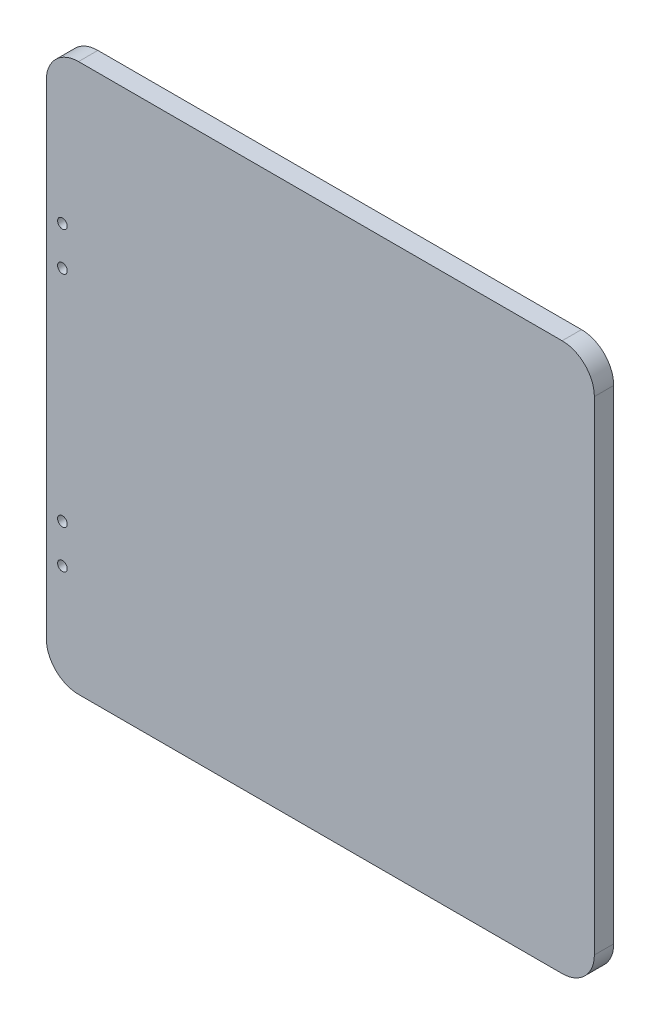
SolidWorks part; units mm, degrees
ref_plane "Front Plane" through (0, 0, 0) normal (0, 0, 1) x (1, 0, 0)
ref_plane "Top Plane" through (0, 0, 0) normal (0, 1, 0) x (1, 0, 0)
ref_plane "Right Plane" through (0, 0, 0) normal (1, 0, 0) x (0, 0, -1)
sketch "Sketch1" plane through (0, 0, 0) normal (0, 0, 1) x (1, 0, 0)
  line L1 (85, -85) -> (-85, -85)
  line L2 (85, -85) -> (85, 85)
  line L3 (85, 85) -> (-85, 85)
  line L4 (-85, -85) -> (-85, 85)
  line L5 (85, -85) -> (-85, 85) construction
  line L6 (85, 85) -> (-85, -85) construction
  point P0 (0, 0)
  dimension "D1" = 170
  dimension "D2" = 170
extrude "Boss-Extrude1" add sketch "Sketch1" along normal blind 6
fillet "Fillet1" radius 10 4 edges at (-85, -85, 3) (85, -85, 3) (85, 85, 3) (-85, 85, 3)
sketch "Sketch2" plane through (0, 0, 6) normal (0, 0, 1) x (1, 0, 0)
  line L0 (75, 85) -> (-75, 85) construction
  line L1 (-85, 75) -> (-85, -75) construction
  line L2 (-80, 39) -> (-80, 27) construction
  line L3 (0, 0) -> (-38.9095, 0) construction
  line L4 (-80, -41) -> (-80, -53) construction
  line L5 (-80, 39) -> (-80, -41) construction
  circle A0 centre (-80, 39) radius 1.5
  circle A1 centre (-80, 27) radius 1.5
  circle A2 centre (-80, -41) radius 1.5
  circle A3 centre (-80, -53) radius 1.5
  dimension "D1" = 46
  dimension "D2" = 5
  dimension "D3" = 3
  dimension "D5" = 12
  dimension "D6" = 2
  dimension "D7" = 80
  dimension "D4" = 2
extrude "Cut-Extrude1" cut sketch "Sketch2" against normal up to next
sketch "Sketch3" plane through (0, 0, 0) normal (0, 0, -1) x (-1, 0, 0)
  line L1 (77.25, 40.5877) -> (77.25, 37.4123)
  line L2 (77.25, 37.4123) -> (80, 35.8246)
  line L3 (80, 35.8246) -> (82.75, 37.4123)
  line L4 (82.75, 37.4123) -> (82.75, 40.5877)
  line L5 (82.75, 40.5877) -> (80, 42.1754)
  line L6 (80, 42.1754) -> (77.25, 40.5877)
  line L7 (77.25, 28.5877) -> (77.25, 25.4123)
  line L8 (77.25, 25.4123) -> (80, 23.8246)
  line L9 (80, 23.8246) -> (82.75, 25.4123)
  line L10 (82.75, 25.4123) -> (82.75, 28.5877)
  line L11 (82.75, 28.5877) -> (80, 30.1754)
  line L12 (80, 30.1754) -> (77.25, 28.5877)
  line L13 (77.25, -39.4123) -> (77.25, -42.5877)
  line L14 (77.25, -42.5877) -> (80, -44.1754)
  line L15 (80, -44.1754) -> (82.75, -42.5877)
  line L16 (82.75, -42.5877) -> (82.75, -39.4123)
  line L17 (82.75, -39.4123) -> (80, -37.8246)
  line L18 (80, -37.8246) -> (77.25, -39.4123)
  line L19 (77.25, -51.4123) -> (77.25, -54.5877)
  line L20 (77.25, -54.5877) -> (80, -56.1754)
  line L21 (80, -56.1754) -> (82.75, -54.5877)
  line L22 (82.75, -54.5877) -> (82.75, -51.4123)
  line L23 (82.75, -51.4123) -> (80, -49.8246)
  line L24 (80, -49.8246) -> (77.25, -51.4123)
  circle A0 centre (80, 39) radius 2.75 construction
  circle A1 centre (80, 27) radius 2.75 construction
  circle A2 centre (80, -41) radius 2.75 construction
  circle A3 centre (80, -53) radius 2.75 construction
  dimension "D1" = 5.5
extrude "Cut-Extrude2" cut sketch "Sketch3" against normal blind 3
